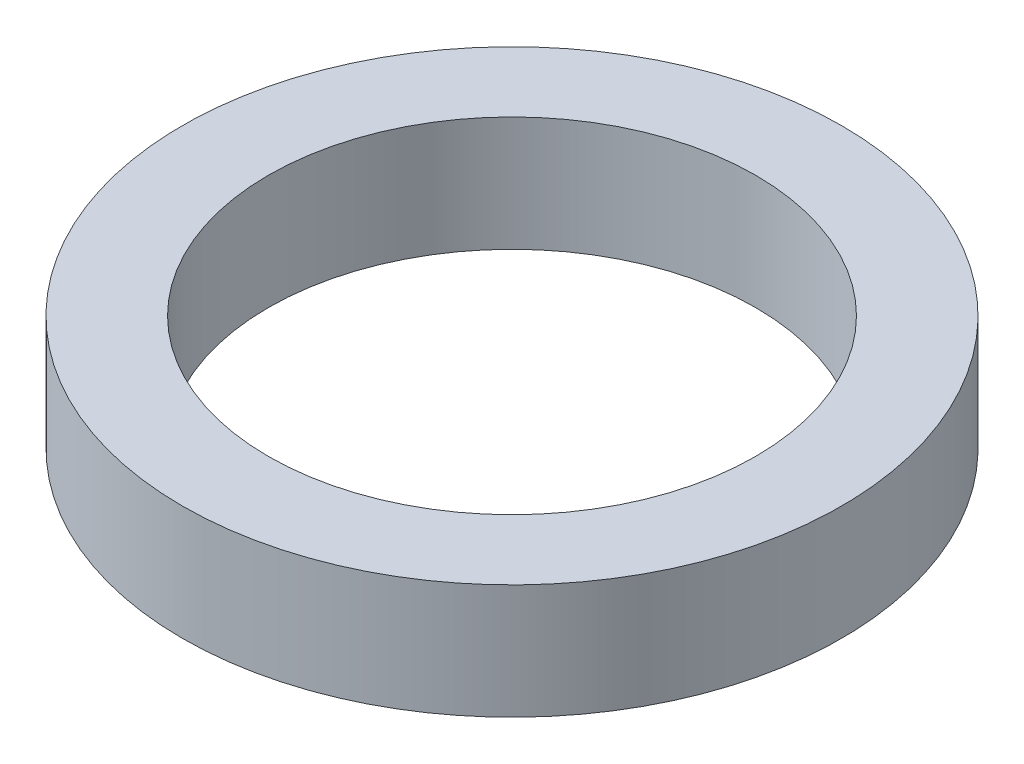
SolidWorks part; units mm, degrees
ref_plane "Alzado" through (0, 0, 0) normal (0, 0, 1) x (1, 0, 0)
ref_plane "Planta" through (0, 0, 0) normal (0, 1, 0) x (1, 0, 0)
ref_plane "Vista lateral" through (0, 0, 0) normal (1, 0, 0) x (0, 0, -1)
sketch "Croquis1" plane through (0, 0, 0) normal (0, 1, 0) x (1, 0, 0)
  circle A0 centre (0, 0) radius 5.75
  circle A1 centre (0, 0) radius 4.25
  dimension "D1" = 11.5
  dimension "D2" = 8.5
extrude "Saliente-Extruir1" add sketch "Croquis1" along normal blind 2
